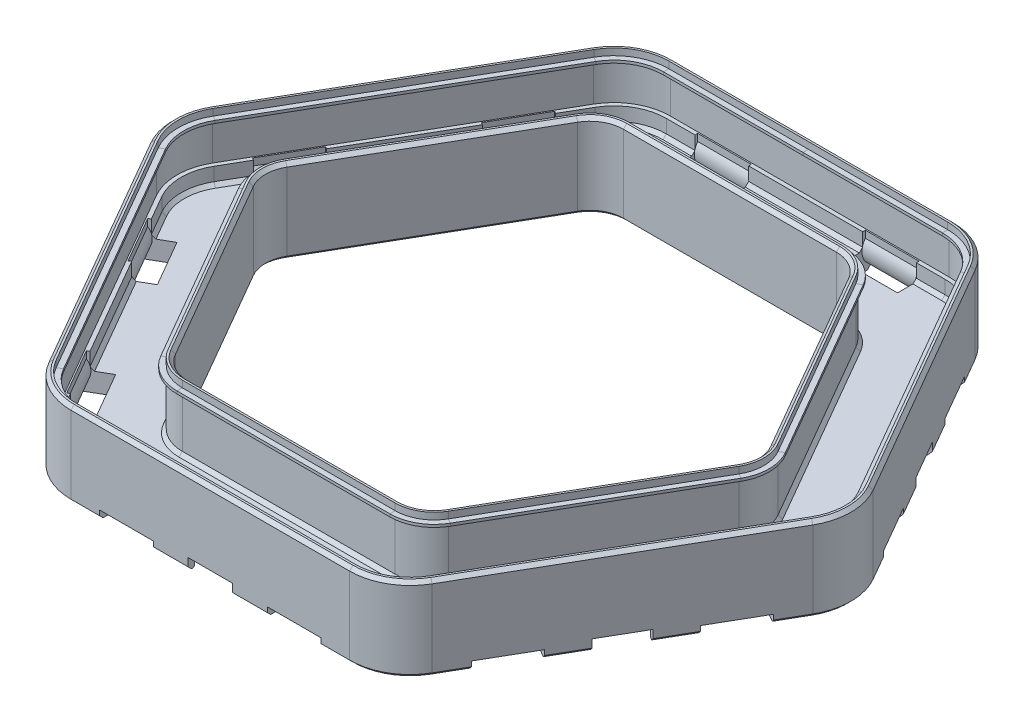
SolidWorks part; units mm, degrees
other "<tile>-<Chanfrein18>"
other "<tile>-<Boss.-Extru.29>"
other "<tile>-<Congé4>"
ref_plane "Plan de face" through (0, 0, 0) normal (0, 0, 1) x (1, 0, 0)
ref_plane "Plan de dessus" through (0, 0, 0) normal (0, 1, 0) x (1, 0, 0)
ref_plane "Plan de droite" through (0, 0, 0) normal (1, 0, 0) x (0, 0, -1)
ref_plane "Plan de face-tile1" through (0, 0, 0) normal (0, 0, 1) x (1, 0, 0)
ref_plane "Plan de dessus-tile1" through (0, 0, 0) normal (0, 1, 0) x (1, 0, 0)
ref_plane "Plan de droite-tile1" through (0, 0, 0) normal (1, 0, 0) x (0, 0, -1)
inserted part "tile1" parameters "D1"=0, "D2"=0, "D3"=0
move or copy body "Corps-Déplacer/Copier2"
sketch "Esquisse1" plane through (0, 5.6, 0) normal (0, 1, 0) x (1, 0, 0)
  line L1 (72.1688, 5) -> (40.4145, 60)
  line L2 (31.7543, 65) -> (-31.7543, 65)
  line L3 (-40.4145, 60) -> (-72.1688, 5)
  line L4 (-72.1688, -5) -> (-40.4145, -60)
  line L5 (-31.7543, -65) -> (31.7543, -65)
  line L6 (40.4145, -60) -> (72.1688, -5)
  line L7 (41.5692, -90) -> (-41.5692, -90) construction
  circle A0 centre (0, 0) radius 65 construction
  arc A1 (-40.4145, -60) -> (-31.7543, -65) centre (-31.7543, -55) ccw
  arc A2 (31.7543, -65) -> (40.4145, -60) centre (31.7543, -55) ccw
  arc A3 (72.1688, 5) -> (72.1688, -5) centre (63.5085, 0) cw
  arc A4 (40.4145, 60) -> (31.7543, 65) centre (31.7543, 55) ccw
  arc A5 (-72.1688, 5) -> (-72.1688, -5) centre (-63.5085, 0) ccw
  arc A6 (-31.7543, 65) -> (-40.4145, 60) centre (-31.7543, 55) ccw
  dimension "D2" = 10
  dimension "D1" = 25
extrude "Enlèv. mat.-Extru.1" cut sketch "Esquisse1" against normal through all contours L3 A5 L4 A1 L5 A2 L6 A3 L1 A4 L2 A6
sketch "Esquisse2" plane through (0, 5.6, 0) normal (0, 1, 0) x (1, 0, 0)
  line L7 (31.7543, 65) -> (-31.7543, 65)
  line L8 (72.1688, 5) -> (40.4145, 60)
  line L9 (40.4145, -60) -> (72.1688, -5)
  line L10 (-31.7543, -65) -> (31.7543, -65)
  line L11 (-72.1688, -5) -> (-40.4145, -60)
  line L12 (-40.4145, 60) -> (-72.1688, 5)
  line L13 (31.7543, 65) -> (-31.7543, 65)
  line L14 (72.1688, 5) -> (40.4145, 60)
  line L15 (40.4145, -60) -> (72.1688, -5)
  line L16 (-31.7543, -65) -> (31.7543, -65)
  line L17 (-72.1688, -5) -> (-40.4145, -60)
  line L18 (-40.4145, 60) -> (-72.1688, 5)
  arc A6 (-31.7543, 65) -> (-40.4145, 60) centre (-31.7543, 55) ccw
  arc A7 (40.4145, 60) -> (31.7543, 65) centre (31.7543, 55) ccw
  arc A8 (72.1688, -5) -> (72.1688, 5) centre (63.5085, 0) ccw
  arc A9 (31.7543, -65) -> (40.4145, -60) centre (31.7543, -55) ccw
  arc A10 (-40.4145, -60) -> (-31.7543, -65) centre (-31.7543, -55) ccw
  arc A11 (-72.1688, 5) -> (-72.1688, -5) centre (-63.5085, 0) ccw
  arc A12 (-31.7543, 65) -> (-40.4145, 60) centre (-31.7543, 55) ccw
  arc A13 (40.4145, 60) -> (31.7543, 65) centre (31.7543, 55) ccw
  arc A14 (72.1688, -5) -> (72.1688, 5) centre (63.5085, 0) ccw
  arc A15 (31.7543, -65) -> (40.4145, -60) centre (31.7543, -55) ccw
  arc A16 (-40.4145, -60) -> (-31.7543, -65) centre (-31.7543, -55) ccw
  arc A17 (-72.1688, 5) -> (-72.1688, -5) centre (-63.5085, 0) ccw
  dimension "D1" = 0
extrude "Extru.-Mince1" add sketch "Esquisse2" along normal up to surface (19.4 mm away) thin
sketch "Esquisse4" plane through (0, 25, 0) normal (0, 1, 0) x (1, 0, 0)
  line L6 (31.7543, 66.6) -> (-31.7543, 66.6)
  line L7 (-41.8002, 60.8) -> (-73.5544, 5.8)
  line L8 (-73.5544, -5.8) -> (-41.8002, -60.8)
  line L9 (-31.7543, -66.6) -> (31.7543, -66.6)
  line L10 (41.8002, -60.8) -> (73.5544, -5.8)
  line L11 (73.5544, 5.8) -> (41.8002, 60.8)
  line L12 (31.7543, 66.6) -> (-31.7543, 66.6)
  line L13 (-41.8002, 60.8) -> (-73.5544, 5.8)
  line L14 (-73.5544, -5.8) -> (-41.8002, -60.8)
  line L15 (-31.7543, -66.6) -> (31.7543, -66.6)
  line L16 (41.8002, -60.8) -> (73.5544, -5.8)
  line L17 (73.5544, 5.8) -> (41.8002, 60.8)
  arc A6 (-31.7543, 66.6) -> (-41.8002, 60.8) centre (-31.7543, 55) ccw
  arc A7 (-73.5544, 5.8) -> (-73.5544, -5.8) centre (-63.5085, 0) ccw
  arc A8 (-41.8002, -60.8) -> (-31.7543, -66.6) centre (-31.7543, -55) ccw
  arc A9 (31.7543, -66.6) -> (41.8002, -60.8) centre (31.7543, -55) ccw
  arc A10 (73.5544, -5.8) -> (73.5544, 5.8) centre (63.5085, 0) ccw
  arc A11 (41.8002, 60.8) -> (31.7543, 66.6) centre (31.7543, 55) ccw
  arc A12 (-31.7543, 66.6) -> (-41.8002, 60.8) centre (-31.7543, 55) ccw
  arc A13 (-73.5544, 5.8) -> (-73.5544, -5.8) centre (-63.5085, 0) ccw
  arc A14 (-41.8002, -60.8) -> (-31.7543, -66.6) centre (-31.7543, -55) ccw
  arc A15 (31.7543, -66.6) -> (41.8002, -60.8) centre (31.7543, -55) ccw
  arc A16 (73.5544, -5.8) -> (73.5544, 5.8) centre (63.5085, 0) ccw
  arc A17 (41.8002, 60.8) -> (31.7543, 66.6) centre (31.7543, 55) ccw
  dimension "D1" = 0
sketch "Esquisse3" plane through (0, 0, 0) normal (1, 0, 0) x (0, 0, -1)
  line L0 (66.6, 23) -> (66.6, 21.2762)
  line L1 (66.6, 21.2762) -> (68.2, 22.2)
  line L2 (68.2, 22.2) -> (68.2, 23)
  line L3 (68.2, 23) -> (66.6, 23)
  line L4 (66.6, 25) -> (66.6, 5.6) construction
  line L6 (88.4, 23) -> (86.8, 23) construction
  line L10 (86.8, 23) -> (86.8, 22.2) construction
  dimension "D1" = 60
sweep "Balayage2" add profiles "Esquisse3" path "Esquisse4"
chamfer "Chanfrein1" distance 1 angle 45 36 edges at (-56.2917, 0, -32.5) (-73.5085, 0, 0) (-56.2917, 0, 32.5) (-36.7543, 0, 63.6603) (0, 0, 65) (36.7543, 0, 63.6603) (56.2917, 0, 32.5) (73.5085, 0, 0) (56.2917, 0, -32.5) (36.7543, 0, -63.6603) (0, 0, -65) (-36.7543, 0, -63.6603) (0, 5.6, -66.6) (37.5543, 5.6, -65.0459) (57.6773, 5.6, -33.3) (75.1085, 5.6, 0) (57.6773, 5.6, 33.3) (37.5543, 5.6, 65.0459) (0, 5.6, 66.6) (-37.5543, 5.6, 65.0459) (-57.6773, 5.6, 33.3) (-75.1085, 5.6, 0) (-57.6773, 5.6, -33.3) (-37.5543, 5.6, -65.0459) (0, 25, -65) (36.7543, 25, -63.6603) (56.2917, 25, -32.5) (73.5085, 25, 0) (56.2917, 25, 32.5) (36.7543, 25, 63.6603) (0, 25, 65) (-36.7543, 25, 63.6603) (-56.2917, 25, 32.5) (-73.5085, 25, 0) (-56.2917, 25, -32.5) (-36.7543, 25, -63.6603)
